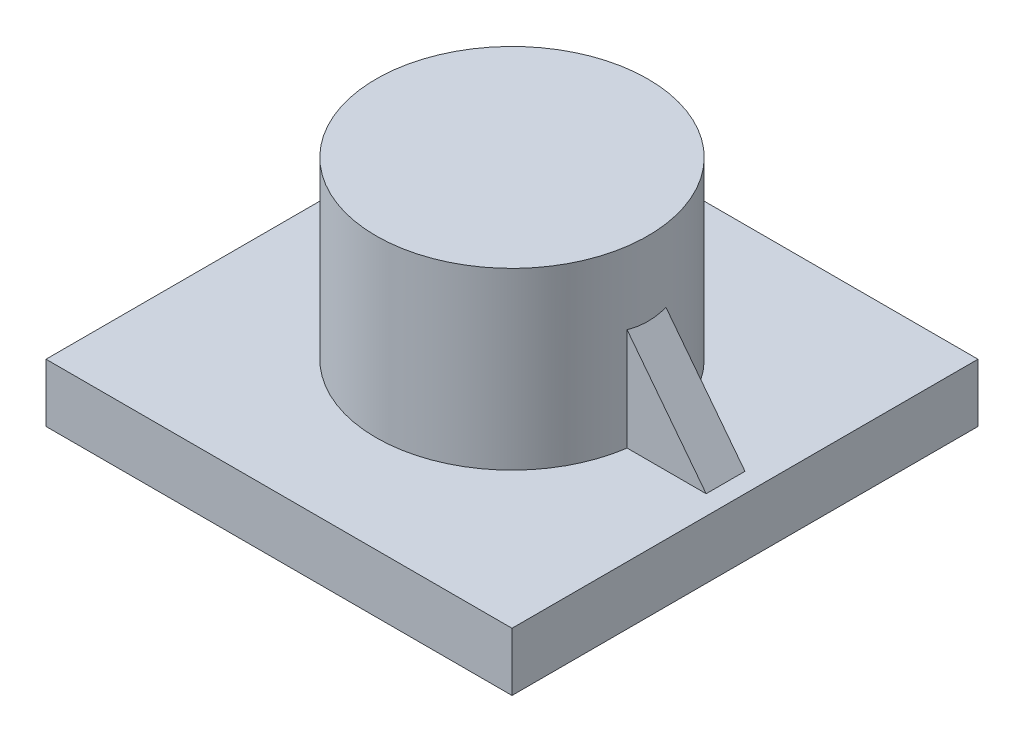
SolidWorks part; units mm, degrees
ref_plane "前视基准面" through (0, 0, 0) normal (0, 0, 1) x (1, 0, 0)
ref_plane "上视基准面" through (0, 0, 0) normal (0, 1, 0) x (1, 0, 0)
ref_plane "右视基准面" through (0, 0, 0) normal (1, 0, 0) x (0, 0, -1)
other "Configuration Table"
sketch "草图1" plane through (0, 0, 0) normal (0, 1, 0) x (1, 0, 0)
  line L0 (-60, -60) -> (60, -60)
  line L1 (60, -60) -> (60, 60)
  line L2 (60, 60) -> (-60, 60)
  line L3 (-60, 60) -> (-60, -60)
extrude "凸台-拉伸1" add sketch "草图1" along normal blind 15
sketch "草图2" plane through (0, 0, 0) normal (0, 1, 0) x (1, 0, 0)
  circle A0 centre (0, 0) radius 35
extrude "凸台-拉伸2" add sketch "草图2" along normal blind 60
sketch "草图3" plane through (0, 0, 0) normal (0, 0, 1) x (1, 0, 0)
  line L0 (28, 15) -> (55, 15)
  line L1 (-60, 15) -> (60, 15) construction
  line L2 (55, 15) -> (28, 50)
  line L3 (28, 50) -> (28, 15)
extrude "凸台-拉伸3" add sketch "草图3" against normal mid plane 10
sketch "草图4" plane through (0, 0, 0) normal (0, 1, 0) x (1, 0, 0)
  circle A0 centre (0, 0) radius 22.5
sketch "草图5" plane through (0, 0, 0) normal (0, 1, 0) x (1, 0, 0)
  circle A0 centre (45, 45) radius 5
sketch "草图6" plane through (0, 0, 0) normal (0, 1, 0) x (1, 0, 0)
  circle A0 centre (-45, 45) radius 5
sketch "草图7" plane through (0, 0, 0) normal (0, 1, 0) x (1, 0, 0)
  circle A0 centre (-45, -45) radius 5
sketch "草图8" plane through (0, 0, 0) normal (0, 1, 0) x (1, 0, 0)
  circle A0 centre (45, -45) radius 5
